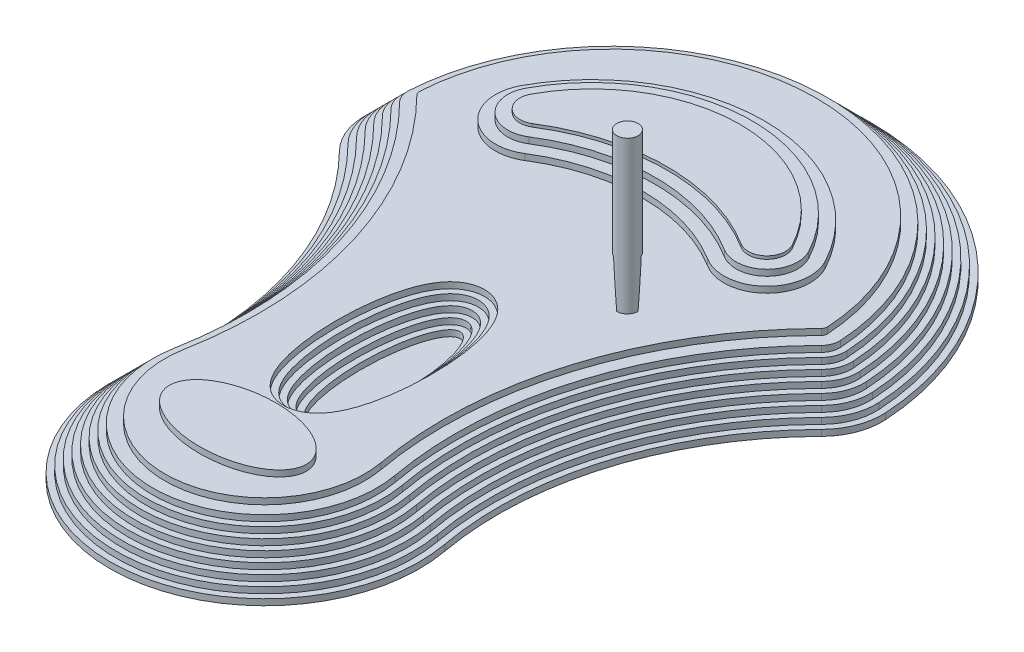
SolidWorks part; units mm, degrees
ref_plane "Front Plane" through (0, 0, 0) normal (0, 0, 1) x (1, 0, 0)
ref_plane "Top Plane" through (0, 0, 0) normal (0, 1, 0) x (1, 0, 0)
ref_plane "Right Plane" through (0, 0, 0) normal (1, 0, 0) x (0, 0, -1)
sketch "Sketch1" plane through (0, 0, 0) normal (0, 1, 0) x (1, 0, 0)
  line L0 (0, 0) -> (0, 250) construction
  line L1 (50, 60) -> (0, 60) construction
  line L2 (85, 160) -> (0, 160) construction
  line L3 (0, 250) -> (-116.0481, 250) construction
  line L4 (0, 0) -> (-44.4749, 0) construction
  arc A0 (0, 250) -> (84.993, 169.8428) centre (0, 164.8611) cw
  arc A1 (79.2344, 154.5957) -> (50, 60) centre (155.2344, 79.293) ccw
  arc A2 (50, 60) -> (0, 0) centre (0, 50.8333) cw
  arc A3 (84.993, 169.8428) -> (79.2344, 154.5957) centre (65.0273, 168.6725) cw
  dimension "D2" = 50
  dimension "D7" = 20
  dimension "D1" = 250
  dimension "D3" = 60
  dimension "D4" = 100
  dimension "D5" = 85
sketch "Sketch2" plane through (0, 0, 0) normal (0, 1, 0) x (1, 0, 0)
  line L0 (0, 0) -> (0, -82.5065) construction
  arc A0 (84.993, 169.8428) -> (0, 250) centre (0, 164.8611) ccw construction
  arc A1 (79.2344, 154.5957) -> (84.993, 169.8428) centre (65.0273, 168.6725) ccw construction
  arc A2 (79.2344, 154.5957) -> (50, 60) centre (155.2344, 79.293) ccw construction
  arc A3 (0, 0) -> (50, 60) centre (0, 50.8333) ccw construction
  arc A4 (84.993, 169.8428) -> (-84.993, 169.8428) centre (0, 164.8611) ccw
  arc A5 (79.2344, 154.5957) -> (84.993, 169.8428) centre (65.0273, 168.6725) ccw
  arc A6 (79.2344, 154.5957) -> (50, 60) centre (155.2344, 79.293) ccw
  arc A7 (-50, 60) -> (50, 60) centre (0, 50.8333) ccw
  arc A8 (-79.2344, 154.5957) -> (-50, 60) centre (-155.2344, 79.293) cw
  arc A9 (-79.2344, 154.5957) -> (-84.993, 169.8428) centre (-65.0273, 168.6725) cw
extrude "Boss-Extrude1" add sketch "Sketch2" along normal blind 2
sketch "Sketch3" plane through (0, 2, 0) normal (0, 1, 0) x (1, 0, 0)
  arc A18 (77.8137, 156.0034) -> (82.9964, 169.7257) centre (65.0273, 168.6725) ccw
  arc A19 (82.9964, 169.7257) -> (-82.9964, 169.7257) centre (0, 164.8611) ccw
  arc A20 (-82.9964, 169.7257) -> (-77.8137, 156.0034) centre (-65.0273, 168.6725) ccw
  arc A21 (-48.0328, 59.6393) -> (-77.8137, 156.0034) centre (-155.2344, 79.293) ccw
  arc A22 (-48.0328, 59.6393) -> (48.0328, 59.6393) centre (0, 50.8333) ccw
  arc A23 (77.8137, 156.0034) -> (48.0328, 59.6393) centre (155.2344, 79.293) ccw
  arc A24 (77.8137, 156.0034) -> (82.9964, 169.7257) centre (65.0273, 168.6725) ccw
  arc A25 (82.9964, 169.7257) -> (-82.9964, 169.7257) centre (0, 164.8611) ccw
  arc A26 (-82.9964, 169.7257) -> (-77.8137, 156.0034) centre (-65.0273, 168.6725) ccw
  arc A27 (-48.0328, 59.6393) -> (-77.8137, 156.0034) centre (-155.2344, 79.293) ccw
  arc A28 (-48.0328, 59.6393) -> (48.0328, 59.6393) centre (0, 50.8333) ccw
  arc A29 (77.8137, 156.0034) -> (48.0328, 59.6393) centre (155.2344, 79.293) ccw
  dimension "D1" = 2
extrude "Boss-Extrude2" add sketch "Sketch3" along normal blind 2
sketch "Sketch4" plane through (0, 4, 0) normal (0, 1, 0) x (1, 0, 0)
  arc A12 (76.393, 157.4111) -> (46.0656, 59.2787) centre (155.2344, 79.293) ccw
  arc A13 (76.393, 157.4111) -> (80.9999, 169.6087) centre (65.0273, 168.6725) ccw
  arc A14 (80.9999, 169.6087) -> (-80.9999, 169.6087) centre (0, 164.8611) ccw
  arc A15 (-80.9999, 169.6087) -> (-76.393, 157.4111) centre (-65.0273, 168.6725) ccw
  arc A16 (-46.0656, 59.2787) -> (-76.393, 157.4111) centre (-155.2344, 79.293) ccw
  arc A17 (-46.0656, 59.2787) -> (46.0656, 59.2787) centre (0, 50.8333) ccw
  arc A18 (76.393, 157.4111) -> (46.0656, 59.2787) centre (155.2344, 79.293) ccw
  arc A19 (76.393, 157.4111) -> (80.9999, 169.6087) centre (65.0273, 168.6725) ccw
  arc A20 (80.9999, 169.6087) -> (-80.9999, 169.6087) centre (0, 164.8611) ccw
  arc A21 (-80.9999, 169.6087) -> (-76.393, 157.4111) centre (-65.0273, 168.6725) ccw
  arc A22 (-46.0656, 59.2787) -> (-76.393, 157.4111) centre (-155.2344, 79.293) ccw
  arc A23 (-46.0656, 59.2787) -> (46.0656, 59.2787) centre (0, 50.8333) ccw
  dimension "D1" = 2
extrude "Boss-Extrude3" add sketch "Sketch4" along normal blind 2
sketch "Sketch5" plane through (0, 6, 0) normal (0, 1, 0) x (1, 0, 0)
  arc A12 (74.9723, 158.8187) -> (79.0033, 169.4917) centre (65.0273, 168.6725) ccw
  arc A13 (79.0033, 169.4917) -> (-79.0033, 169.4917) centre (0, 164.8611) ccw
  arc A14 (-79.0033, 169.4917) -> (-74.9723, 158.8187) centre (-65.0273, 168.6725) ccw
  arc A15 (-44.0984, 58.918) -> (-74.9723, 158.8187) centre (-155.2344, 79.293) ccw
  arc A16 (-44.0984, 58.918) -> (44.0984, 58.918) centre (0, 50.8333) ccw
  arc A17 (74.9723, 158.8187) -> (44.0984, 58.918) centre (155.2344, 79.293) ccw
  arc A18 (74.9723, 158.8187) -> (79.0033, 169.4917) centre (65.0273, 168.6725) ccw
  arc A19 (79.0033, 169.4917) -> (-79.0033, 169.4917) centre (0, 164.8611) ccw
  arc A20 (-79.0033, 169.4917) -> (-74.9723, 158.8187) centre (-65.0273, 168.6725) ccw
  arc A21 (-44.0984, 58.918) -> (-74.9723, 158.8187) centre (-155.2344, 79.293) ccw
  arc A22 (-44.0984, 58.918) -> (44.0984, 58.918) centre (0, 50.8333) ccw
  arc A23 (74.9723, 158.8187) -> (44.0984, 58.918) centre (155.2344, 79.293) ccw
  dimension "D1" = 2
extrude "Boss-Extrude4" add sketch "Sketch5" along normal blind 2
sketch "Sketch6" plane through (0, 8, 0) normal (0, 1, 0) x (1, 0, 0)
  line L0 (0, 0) -> (0, 303.3461) construction
  arc A12 (73.5516, 160.2264) -> (42.1311, 58.5574) centre (155.2344, 79.293) ccw
  arc A13 (73.5516, 160.2264) -> (77.0067, 169.3747) centre (65.0273, 168.6725) ccw
  arc A14 (77.0067, 169.3747) -> (-77.0067, 169.3747) centre (0, 164.8611) ccw
  arc A15 (-77.0067, 169.3747) -> (-73.5516, 160.2264) centre (-65.0273, 168.6725) ccw
  arc A16 (-42.1311, 58.5574) -> (-73.5516, 160.2264) centre (-155.2344, 79.293) ccw
  arc A17 (-42.1311, 58.5574) -> (42.1311, 58.5574) centre (0, 50.8333) ccw
  arc A18 (73.5516, 160.2264) -> (42.1311, 58.5574) centre (155.2344, 79.293) ccw
  arc A19 (73.5516, 160.2264) -> (77.0067, 169.3747) centre (65.0273, 168.6725) ccw
  arc A20 (77.0067, 169.3747) -> (-77.0067, 169.3747) centre (0, 164.8611) ccw
  arc A21 (-77.0067, 169.3747) -> (-73.5516, 160.2264) centre (-65.0273, 168.6725) ccw
  arc A22 (-42.1311, 58.5574) -> (-73.5516, 160.2264) centre (-155.2344, 79.293) ccw
  arc A23 (-42.1311, 58.5574) -> (42.1311, 58.5574) centre (0, 50.8333) ccw
  ellipse E0 centre (0, 90) end of major axis (0, 115) minor radius 7.5
  dimension "D1" = 50
  dimension "D2" = 65
  dimension "D3" = 15
  dimension "D4" = 2
extrude "Boss-Extrude5" add sketch "Sketch6" along normal blind 2
sketch "Sketch7" plane through (0, 10, 0) normal (0, 1, 0) x (1, 0, 0)
  arc A12 (72.1309, 161.6341) -> (75.0102, 169.2576) centre (65.0273, 168.6725) ccw
  arc A13 (75.0102, 169.2576) -> (-75.0102, 169.2576) centre (0, 164.8611) ccw
  arc A14 (-75.0102, 169.2576) -> (-72.1309, 161.6341) centre (-65.0273, 168.6725) ccw
  arc A15 (-40.1639, 58.1967) -> (-72.1309, 161.6341) centre (-155.2344, 79.293) ccw
  arc A16 (-40.1639, 58.1967) -> (40.1639, 58.1967) centre (0, 50.8333) ccw
  arc A17 (72.1309, 161.6341) -> (40.1639, 58.1967) centre (155.2344, 79.293) ccw
  arc A18 (72.1309, 161.6341) -> (75.0102, 169.2576) centre (65.0273, 168.6725) ccw
  arc A19 (75.0102, 169.2576) -> (-75.0102, 169.2576) centre (0, 164.8611) ccw
  arc A20 (-75.0102, 169.2576) -> (-72.1309, 161.6341) centre (-65.0273, 168.6725) ccw
  arc A21 (-40.1639, 58.1967) -> (-72.1309, 161.6341) centre (-155.2344, 79.293) ccw
  arc A22 (-40.1639, 58.1967) -> (40.1639, 58.1967) centre (0, 50.8333) ccw
  arc A23 (72.1309, 161.6341) -> (40.1639, 58.1967) centre (155.2344, 79.293) ccw
  spline S0 degree 3 number of poles 105 (0, 63) -> (0, 63)
  spline S1 degree 3 number of poles 105 (0, 63) -> (0, 63)
  dimension "D1" = 2
  dimension "D2" = 2
extrude "Boss-Extrude6" add sketch "Sketch7" along normal blind 2
sketch "Sketch8" plane through (0, 12, 0) normal (0, 1, 0) x (1, 0, 0)
  arc A12 (70.7101, 163.0418) -> (38.1967, 57.8361) centre (155.2344, 79.293) ccw
  arc A13 (70.7101, 163.0418) -> (73.0136, 169.1406) centre (65.0273, 168.6725) ccw
  arc A14 (73.0136, 169.1406) -> (-73.0136, 169.1406) centre (0, 164.8611) ccw
  arc A15 (-73.0136, 169.1406) -> (-70.7101, 163.0418) centre (-65.0273, 168.6725) ccw
  arc A16 (-38.1967, 57.8361) -> (-70.7101, 163.0418) centre (-155.2344, 79.293) ccw
  arc A17 (-38.1967, 57.8361) -> (38.1967, 57.8361) centre (0, 50.8333) ccw
  arc A18 (70.7101, 163.0418) -> (38.1967, 57.8361) centre (155.2344, 79.293) ccw
  arc A19 (70.7101, 163.0418) -> (73.0136, 169.1406) centre (65.0273, 168.6725) ccw
  arc A20 (73.0136, 169.1406) -> (-73.0136, 169.1406) centre (0, 164.8611) ccw
  arc A21 (-73.0136, 169.1406) -> (-70.7101, 163.0418) centre (-65.0273, 168.6725) ccw
  arc A22 (-38.1967, 57.8361) -> (-70.7101, 163.0418) centre (-155.2344, 79.293) ccw
  arc A23 (-38.1967, 57.8361) -> (38.1967, 57.8361) centre (0, 50.8333) ccw
  spline S2 degree 3 number of poles 111 (-0.0534, 118.9998) -> (-0.0534, 118.9998)
  spline S3 degree 3 number of poles 111 (-0.0534, 118.9998) -> (-0.0534, 118.9998)
  dimension "D1" = 2
  dimension "D2" = 2
extrude "Boss-Extrude7" add sketch "Sketch8" along normal blind 2
sketch "Sketch9" plane through (0, 14, 0) normal (0, 1, 0) x (1, 0, 0)
  arc A12 (69.2894, 164.4495) -> (71.017, 169.0236) centre (65.0273, 168.6725) ccw
  arc A13 (71.017, 169.0236) -> (-71.017, 169.0236) centre (0, 164.8611) ccw
  arc A14 (-71.017, 169.0236) -> (-69.2894, 164.4495) centre (-65.0273, 168.6725) ccw
  arc A15 (-36.2295, 57.4754) -> (-69.2894, 164.4495) centre (-155.2344, 79.293) ccw
  arc A16 (-36.2295, 57.4754) -> (36.2295, 57.4754) centre (0, 50.8333) ccw
  arc A17 (69.2894, 164.4495) -> (36.2295, 57.4754) centre (155.2344, 79.293) ccw
  arc A18 (69.2894, 164.4495) -> (71.017, 169.0236) centre (65.0273, 168.6725) ccw
  arc A19 (71.017, 169.0236) -> (-71.017, 169.0236) centre (0, 164.8611) ccw
  arc A20 (-71.017, 169.0236) -> (-69.2894, 164.4495) centre (-65.0273, 168.6725) ccw
  arc A21 (-36.2295, 57.4754) -> (-69.2894, 164.4495) centre (-155.2344, 79.293) ccw
  arc A22 (-36.2295, 57.4754) -> (36.2295, 57.4754) centre (0, 50.8333) ccw
  arc A23 (69.2894, 164.4495) -> (36.2295, 57.4754) centre (155.2344, 79.293) ccw
  spline S3 degree 3 number of poles 119 (-0.0126, 59) -> (-0.0126, 59)
  spline S4 degree 3 number of poles 119 (-0.0126, 59) -> (-0.0126, 59)
  dimension "D1" = 2
  dimension "D2" = 2
extrude "Boss-Extrude8" add sketch "Sketch9" along normal blind 2
sketch "Sketch10" plane through (0, 16, 0) normal (0, 1, 0) x (1, 0, 0)
  arc A12 (66.448, 167.2648) -> (32.2951, 56.7541) centre (155.2344, 79.293) ccw
  arc A13 (66.448, 167.2648) -> (67.0239, 168.7895) centre (65.0273, 168.6725) ccw
  arc A14 (67.0239, 168.7895) -> (-67.0239, 168.7895) centre (0, 164.8611) ccw
  arc A15 (-67.0239, 168.7895) -> (-66.448, 167.2648) centre (-65.0273, 168.6725) ccw
  arc A16 (-32.2951, 56.7541) -> (-66.448, 167.2648) centre (-155.2344, 79.293) ccw
  arc A17 (-32.2951, 56.7541) -> (32.2951, 56.7541) centre (0, 50.8333) ccw
  arc A18 (66.448, 167.2648) -> (32.2951, 56.7541) centre (155.2344, 79.293) ccw
  arc A19 (66.448, 167.2648) -> (67.0239, 168.7895) centre (65.0273, 168.6725) ccw
  arc A20 (67.0239, 168.7895) -> (-67.0239, 168.7895) centre (0, 164.8611) ccw
  arc A21 (-67.0239, 168.7895) -> (-66.448, 167.2648) centre (-65.0273, 168.6725) ccw
  arc A22 (-32.2951, 56.7541) -> (-66.448, 167.2648) centre (-155.2344, 79.293) ccw
  arc A23 (-32.2951, 56.7541) -> (32.2951, 56.7541) centre (0, 50.8333) ccw
  spline S4 degree 3 number of poles 115 (-0.0223, 123) -> (-0.0223, 123)
  spline S5 degree 3 number of poles 115 (-0.0223, 123) -> (-0.0223, 123)
  dimension "D1" = 4
  dimension "D2" = 2
extrude "Boss-Extrude9" add sketch "Sketch10" along normal blind 2
sketch "Sketch11" plane through (0, 18, 0) normal (0, 1, 0) x (1, 0, 0)
  line L0 (-50, 185) -> (50, 185) construction
  line L1 (0, 0) -> (0, 185) construction
  line L2 (0, 175) -> (-18.0541, 175) construction
  arc A0 (-50, 185) -> (50, 185) centre (0, 158.3333) cw
  arc A1 (50, 185) -> (30, 166.3644) centre (37.5198, 178.3439) cw
  arc A2 (30, 166.3644) -> (-30, 166.3644) centre (0, 118.5726) ccw
  arc A3 (-50, 185) -> (-30, 166.3644) centre (-37.5198, 178.3439) ccw
  circle A4 centre (0, 42) radius 12.5 construction
  ellipse E0 centre (0, 42) end of major axis (-22.5, 42) minor radius 12.5
  point P6 (0, 215)
  dimension "D1" = 100
  dimension "D3" = 30
  dimension "D4" = 10
  dimension "D5" = 30
  dimension "D6" = 25
  dimension "D7" = 42
  dimension "D2" = 185
  dimension "D8" = 45
extrude "Boss-Extrude10" add sketch "Sketch11" along normal blind 2
sketch "Sketch12" plane through (0, 20, 0) normal (0, 1, 0) x (1, 0, 0)
  arc A8 (-46.4706, 183.1176) -> (-32.1266, 169.7522) centre (-37.5198, 178.3439) ccw
  arc A9 (32.1266, 169.7522) -> (-32.1266, 169.7522) centre (0, 118.5726) ccw
  arc A10 (32.1266, 169.7522) -> (46.4706, 183.1176) centre (37.5198, 178.3439) ccw
  arc A11 (46.4706, 183.1176) -> (-46.4706, 183.1176) centre (0, 158.3333) ccw
  arc A12 (-46.4706, 183.1176) -> (-32.1266, 169.7522) centre (-37.5198, 178.3439) ccw
  arc A13 (32.1266, 169.7522) -> (-32.1266, 169.7522) centre (0, 118.5726) ccw
  arc A14 (32.1266, 169.7522) -> (46.4706, 183.1176) centre (37.5198, 178.3439) ccw
  arc A15 (46.4706, 183.1176) -> (-46.4706, 183.1176) centre (0, 158.3333) ccw
  dimension "D1" = 4
extrude "Boss-Extrude11" add sketch "Sketch12" along normal blind 2
sketch "Sketch13" plane through (0, 22, 0) normal (0, 1, 0) x (1, 0, 0)
  arc A8 (42.9412, 181.2353) -> (-42.9412, 181.2353) centre (0, 158.3333) ccw
  arc A9 (-42.9412, 181.2353) -> (-34.2533, 173.14) centre (-37.5198, 178.3439) ccw
  arc A10 (34.2533, 173.14) -> (-34.2533, 173.14) centre (0, 118.5726) ccw
  arc A11 (34.2533, 173.14) -> (42.9412, 181.2353) centre (37.5198, 178.3439) ccw
  arc A12 (42.9412, 181.2353) -> (-42.9412, 181.2353) centre (0, 158.3333) ccw
  arc A13 (-42.9412, 181.2353) -> (-34.2533, 173.14) centre (-37.5198, 178.3439) ccw
  arc A14 (34.2533, 173.14) -> (-34.2533, 173.14) centre (0, 118.5726) ccw
  arc A15 (34.2533, 173.14) -> (42.9412, 181.2353) centre (37.5198, 178.3439) ccw
  dimension "D1" = 4
extrude "Boss-Extrude12" add sketch "Sketch13" along normal blind 1
sketch "Sketch14" plane through (0, 18, 0) normal (0, 1, 0) x (1, 0, 0)
  circle A0 centre (30, 140) radius 3.5
  dimension "D1" = 140
  dimension "D3" = 7
  dimension "D2" = 30
extrude "Boss-Extrude13" add sketch "Sketch14" along normal blind 50 from offset 2 separate body
sketch "Sketch15" plane through (0, 20, 0) normal (0, -1, 0) x (1, 0, 0)
  line L0 (30, -140) -> (26.5, -140)
  line L1 (30, -140) -> (30, -136.5)
  line L2 (30, -136.5) -> (30, -132.6555)
  line L3 (35.1783, -139.0632) -> (35.1988, -139.0529)
  line L4 (30, -132.6555) -> (23.2259, -140)
  line L5 (23.2259, -140) -> (26.5, -140)
  line L6 (30, -140) -> (37.6715, -140)
  line L7 (37.6715, -140) -> (30, -148.3175)
  line L8 (30, -148.3175) -> (30, -140)
  circle A0 centre (30, -140) radius 3.5 construction
extrude "Cut-Extrude1" cut sketch "Sketch15" against normal blind 15 draft 5 contours L8 L6 M1 | L8 L7 L6 M1 | L0 L1 M1 | L4 L5 L2 M1
